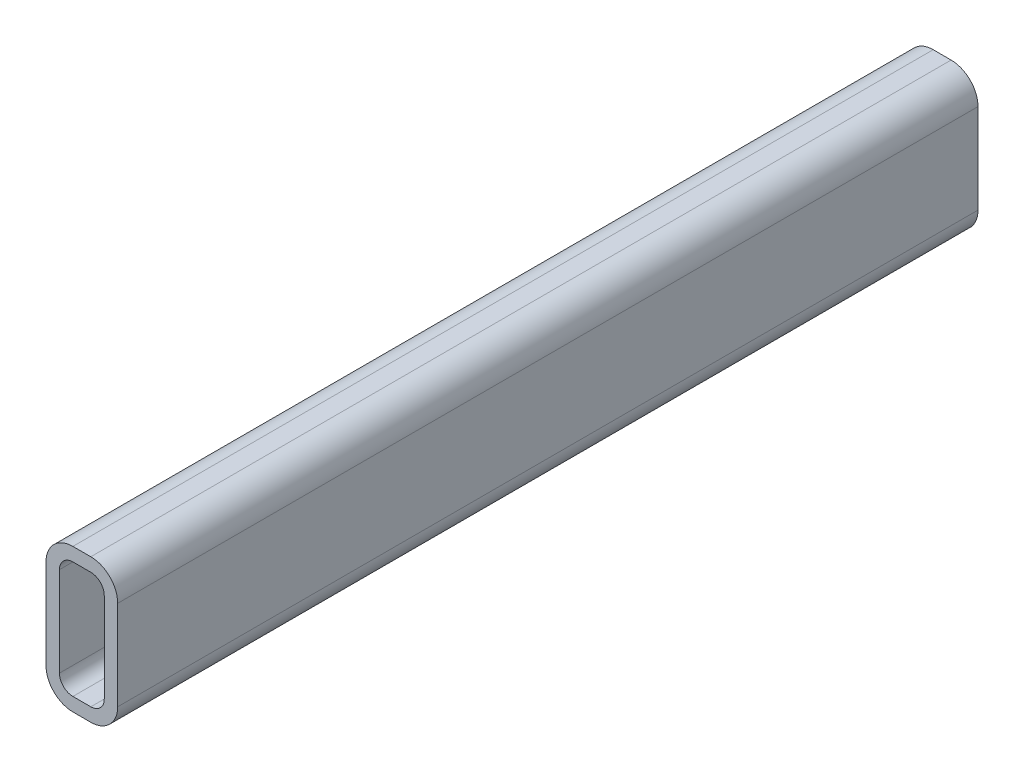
SolidWorks part; units mm, degrees
ref_plane "Front Plane" through (0, 0, 0) normal (0, 0, 1) x (1, 0, 0)
ref_plane "Top Plane" through (0, 0, 0) normal (0, 1, 0) x (1, 0, 0)
ref_plane "Right Plane" through (0, 0, 0) normal (1, 0, 0) x (0, 0, -1)
sketch "Sketch1" plane through (0, 0, 0) normal (0, 0, 1) x (1, 0, 0)
  line B0 (9.525, 50.8) -> (15.875, 50.8)
  arc B1 (25.4, 41.275) -> (15.875, 50.8) centre (15.875, 41.275) ccw
  line B2 (25.4, 41.275) -> (25.4, 9.525)
  arc B3 (15.875, 0) -> (25.4, 9.525) centre (15.875, 9.525) ccw
  line B4 (15.875, 0) -> (9.525, 0)
  arc B5 (0, 9.525) -> (9.525, 0) centre (9.525, 9.525) ccw
  line B6 (0, 9.525) -> (0, 41.275)
  arc B7 (9.525, 50.8) -> (0, 41.275) centre (9.525, 41.275) ccw
  line B8 (9.525, 46.0375) -> (15.875, 46.0375)
  arc B9 (20.6375, 41.275) -> (15.875, 46.0375) centre (15.875, 41.275) ccw
  line B10 (20.6375, 41.275) -> (20.6375, 9.525)
  arc B11 (15.875, 4.7625) -> (20.6375, 9.525) centre (15.875, 9.525) ccw
  line B12 (15.875, 4.7625) -> (9.525, 4.7625)
  arc B13 (4.7625, 9.525) -> (9.525, 4.7625) centre (9.525, 9.525) ccw
  line B14 (4.7625, 9.525) -> (4.7625, 41.275)
  arc B15 (9.525, 46.0375) -> (4.7625, 41.275) centre (9.525, 41.275) ccw
sketch_block_instance "HSS2x1x0.1875-1"
sketch_block "HSS2x1x0.1875"
extrude "Boss-Extrude1" add sketch "Sketch1" along normal blind 304.8
